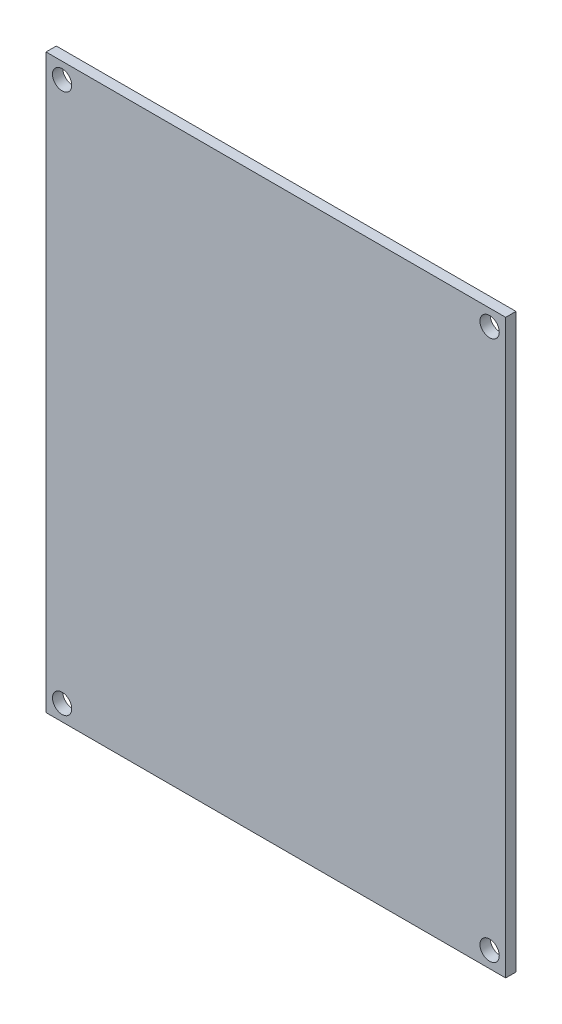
SolidWorks part; units mm, degrees
ref_plane "Alzado" through (0, 0, 0) normal (0, 0, 1) x (1, 0, 0)
ref_plane "Planta" through (0, 0, 0) normal (0, 1, 0) x (1, 0, 0)
ref_plane "Vista lateral" through (0, 0, 0) normal (1, 0, 0) x (0, 0, -1)
sketch "Sketch1" plane through (0, 0, 0) normal (0, 0, 1) x (1, 0, 0)
  line L0 (18.5, 42) -> (85, -42) construction
  line L2 (85, -42) -> (18.5, -42) construction
  line L3 (85, -42) -> (85, 42) construction
  line L4 (85, 42) -> (18.5, 42) construction
  line L5 (18.5, -42) -> (18.5, 42) construction
  line L6 (51.75, 42) -> (51.75, -42) construction
  line L7 (85, 0) -> (18.5, 0) construction
  line L9 (87.5, -44.5) -> (87.5, 44.5)
  line L10 (87.5, 44.5) -> (16, 44.5)
  line L11 (16, -44.5) -> (16, 44.5)
  line L12 (87.5, -44.5) -> (16, -44.5)
  circle A0 centre (18.5, -42) radius 1.5 construction
  circle A1 centre (85, -42) radius 1.5 construction
  circle A2 centre (85, 42) radius 1.5 construction
  circle A3 centre (18.5, 42) radius 1.5 construction
  circle A4 centre (18.5, -42) radius 1.5
  circle A5 centre (85, -42) radius 1.5
  circle A6 centre (85, 42) radius 1.5
  circle A7 centre (18.5, 42) radius 1.5
  point P12 (51.75, 0)
  dimension "D1" = 2.5
extrude "Boss-Extrude1" add sketch "Sketch1" along normal blind 1.6
